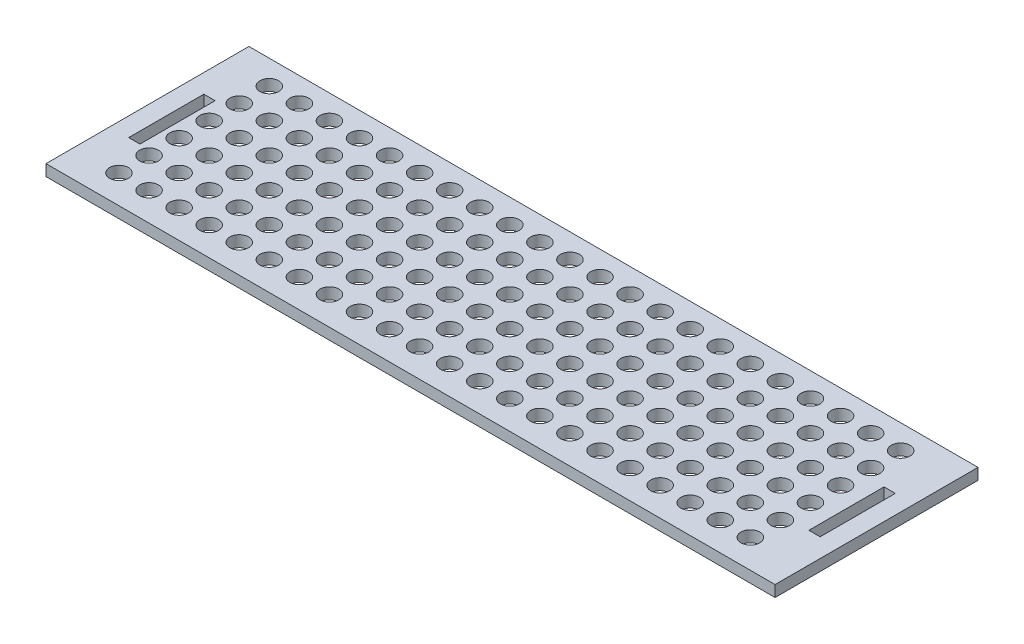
SolidWorks part; units mm, degrees
ref_plane "Front Plane" through (0, 0, 0) normal (0, 0, 1) x (1, 0, 0)
ref_plane "Top Plane" through (0, 0, 0) normal (0, 1, 0) x (1, 0, 0)
ref_plane "Right Plane" through (0, 0, 0) normal (1, 0, 0) x (0, 0, -1)
sketch "Sketch1" plane through (0, 0, 0) normal (0, 1, 0) x (1, 0, 0)
  line L0 (50.8029, -38.0444) -> (50.8029, -58.0444)
  line L1 (-138.1971, -21.0444) -> (55.8029, -21.0444)
  line L2 (-138.1971, -21.0444) -> (-138.1971, -75.0444)
  line L3 (-138.1971, -75.0444) -> (55.8029, -75.0444)
  line L4 (55.8029, -21.0444) -> (55.8029, -75.0444)
  line L6 (47.8029, -38.0444) -> (47.8029, -58.0444)
  line L8 (-130.1971, -38.0444) -> (-130.1971, -58.0444)
  line L9 (-130.1971, -58.0444) -> (-133.1971, -58.0444)
  line L11 (-130.1971, -38.0444) -> (-133.1971, -38.0444)
  line L12 (-133.1971, -38.0444) -> (-133.1971, -58.0444)
  line L14 (47.8029, -58.0444) -> (50.8029, -58.0444)
  line L15 (47.8029, -38.0444) -> (50.8029, -38.0444)
  circle A0 centre (-126.3416, -27.4784) radius 2.5
  circle A1 centre (-118.3416, -27.4784) radius 2.5
  circle A2 centre (-110.3416, -27.4784) radius 2.5
  circle A3 centre (-102.3416, -27.4784) radius 2.5
  circle A4 centre (-94.3416, -27.4784) radius 2.5
  circle A5 centre (-86.3416, -27.4784) radius 2.5
  circle A6 centre (-78.3416, -27.4784) radius 2.5
  circle A7 centre (-70.3416, -27.4784) radius 2.5
  circle A8 centre (-62.3416, -27.4784) radius 2.5
  circle A9 centre (-54.3416, -27.4784) radius 2.5
  circle A10 centre (-46.3416, -27.4784) radius 2.5
  circle A11 centre (-38.3416, -27.4784) radius 2.5
  circle A12 centre (-30.3416, -27.4784) radius 2.5
  circle A13 centre (-22.3416, -27.4784) radius 2.5
  circle A14 centre (-14.3416, -27.4784) radius 2.5
  circle A15 centre (-6.3416, -27.4784) radius 2.5
  circle A16 centre (1.6584, -27.4784) radius 2.5
  circle A17 centre (9.6584, -27.4784) radius 2.5
  circle A18 centre (17.6584, -27.4784) radius 2.5
  circle A19 centre (25.6584, -27.4784) radius 2.5
  circle A20 centre (33.6584, -27.4784) radius 2.5
  circle A21 centre (41.6584, -27.4784) radius 2.5
  circle A22 centre (-126.3416, -35.4784) radius 2.5
  circle A23 centre (-118.3416, -35.4784) radius 2.5
  circle A24 centre (-110.3416, -35.4784) radius 2.5
  circle A25 centre (-102.3416, -35.4784) radius 2.5
  circle A26 centre (-94.3416, -35.4784) radius 2.5
  circle A27 centre (-86.3416, -35.4784) radius 2.5
  circle A28 centre (-78.3416, -35.4784) radius 2.5
  circle A29 centre (-70.3416, -35.4784) radius 2.5
  circle A30 centre (-62.3416, -35.4784) radius 2.5
  circle A31 centre (-54.3416, -35.4784) radius 2.5
  circle A32 centre (-46.3416, -35.4784) radius 2.5
  circle A33 centre (-38.3416, -35.4784) radius 2.5
  circle A34 centre (-30.3416, -35.4784) radius 2.5
  circle A35 centre (-22.3416, -35.4784) radius 2.5
  circle A36 centre (-14.3416, -35.4784) radius 2.5
  circle A37 centre (-6.3416, -35.4784) radius 2.5
  circle A38 centre (1.6584, -35.4784) radius 2.5
  circle A39 centre (9.6584, -35.4784) radius 2.5
  circle A40 centre (17.6584, -35.4784) radius 2.5
  circle A41 centre (25.6584, -35.4784) radius 2.5
  circle A42 centre (33.6584, -35.4784) radius 2.5
  circle A43 centre (41.6584, -35.4784) radius 2.5
  circle A44 centre (-126.3416, -43.4784) radius 2.5
  circle A45 centre (-118.3416, -43.4784) radius 2.5
  circle A46 centre (-110.3416, -43.4784) radius 2.5
  circle A47 centre (-102.3416, -43.4784) radius 2.5
  circle A48 centre (-94.3416, -43.4784) radius 2.5
  circle A49 centre (-86.3416, -43.4784) radius 2.5
  circle A50 centre (-78.3416, -43.4784) radius 2.5
  circle A51 centre (-70.3416, -43.4784) radius 2.5
  circle A52 centre (-62.3416, -43.4784) radius 2.5
  circle A53 centre (-54.3416, -43.4784) radius 2.5
  circle A54 centre (-46.3416, -43.4784) radius 2.5
  circle A55 centre (-38.3416, -43.4784) radius 2.5
  circle A56 centre (-30.3416, -43.4784) radius 2.5
  circle A57 centre (-22.3416, -43.4784) radius 2.5
  circle A58 centre (-14.3416, -43.4784) radius 2.5
  circle A59 centre (-6.3416, -43.4784) radius 2.5
  circle A60 centre (1.6584, -43.4784) radius 2.5
  circle A61 centre (9.6584, -43.4784) radius 2.5
  circle A62 centre (17.6584, -43.4784) radius 2.5
  circle A63 centre (25.6584, -43.4784) radius 2.5
  circle A64 centre (33.6584, -43.4784) radius 2.5
  circle A65 centre (41.6584, -43.4784) radius 2.5
  circle A66 centre (-126.3416, -51.4784) radius 2.5
  circle A67 centre (-118.3416, -51.4784) radius 2.5
  circle A68 centre (-110.3416, -51.4784) radius 2.5
  circle A69 centre (-102.3416, -51.4784) radius 2.5
  circle A70 centre (-94.3416, -51.4784) radius 2.5
  circle A71 centre (-86.3416, -51.4784) radius 2.5
  circle A72 centre (-78.3416, -51.4784) radius 2.5
  circle A73 centre (-70.3416, -51.4784) radius 2.5
  circle A74 centre (-62.3416, -51.4784) radius 2.5
  circle A75 centre (-54.3416, -51.4784) radius 2.5
  circle A76 centre (-46.3416, -51.4784) radius 2.5
  circle A77 centre (-38.3416, -51.4784) radius 2.5
  circle A78 centre (-30.3416, -51.4784) radius 2.5
  circle A79 centre (-22.3416, -51.4784) radius 2.5
  circle A80 centre (-14.3416, -51.4784) radius 2.5
  circle A81 centre (-6.3416, -51.4784) radius 2.5
  circle A82 centre (1.6584, -51.4784) radius 2.5
  circle A83 centre (9.6584, -51.4784) radius 2.5
  circle A84 centre (17.6584, -51.4784) radius 2.5
  circle A85 centre (25.6584, -51.4784) radius 2.5
  circle A86 centre (33.6584, -51.4784) radius 2.5
  circle A87 centre (41.6584, -51.4784) radius 2.5
  circle A88 centre (-126.3416, -59.4784) radius 2.5
  circle A89 centre (-118.3416, -59.4784) radius 2.5
  circle A90 centre (-110.3416, -59.4784) radius 2.5
  circle A91 centre (-102.3416, -59.4784) radius 2.5
  circle A92 centre (-94.3416, -59.4784) radius 2.5
  circle A93 centre (-86.3416, -59.4784) radius 2.5
  circle A94 centre (-78.3416, -59.4784) radius 2.5
  circle A95 centre (-70.3416, -59.4784) radius 2.5
  circle A96 centre (-62.3416, -59.4784) radius 2.5
  circle A97 centre (-54.3416, -59.4784) radius 2.5
  circle A98 centre (-46.3416, -59.4784) radius 2.5
  circle A99 centre (-38.3416, -59.4784) radius 2.5
  circle A100 centre (-30.3416, -59.4784) radius 2.5
  circle A101 centre (-22.3416, -59.4784) radius 2.5
  circle A102 centre (-14.3416, -59.4784) radius 2.5
  circle A103 centre (-6.3416, -59.4784) radius 2.5
  circle A104 centre (1.6584, -59.4784) radius 2.5
  circle A105 centre (9.6584, -59.4784) radius 2.5
  circle A106 centre (17.6584, -59.4784) radius 2.5
  circle A107 centre (25.6584, -59.4784) radius 2.5
  circle A108 centre (33.6584, -59.4784) radius 2.5
  circle A109 centre (41.6584, -59.4784) radius 2.5
  circle A110 centre (-126.3416, -67.4784) radius 2.5
  circle A111 centre (-118.3416, -67.4784) radius 2.5
  circle A112 centre (-110.3416, -67.4784) radius 2.5
  circle A113 centre (-102.3416, -67.4784) radius 2.5
  circle A114 centre (-94.3416, -67.4784) radius 2.5
  circle A115 centre (-86.3416, -67.4784) radius 2.5
  circle A116 centre (-78.3416, -67.4784) radius 2.5
  circle A117 centre (-70.3416, -67.4784) radius 2.5
  circle A118 centre (-62.3416, -67.4784) radius 2.5
  circle A119 centre (-54.3416, -67.4784) radius 2.5
  circle A120 centre (-46.3416, -67.4784) radius 2.5
  circle A121 centre (-38.3416, -67.4784) radius 2.5
  circle A122 centre (-30.3416, -67.4784) radius 2.5
  circle A123 centre (-22.3416, -67.4784) radius 2.5
  circle A124 centre (-14.3416, -67.4784) radius 2.5
  circle A125 centre (-6.3416, -67.4784) radius 2.5
  circle A126 centre (1.6584, -67.4784) radius 2.5
  circle A127 centre (9.6584, -67.4784) radius 2.5
  circle A128 centre (17.6584, -67.4784) radius 2.5
  circle A129 centre (25.6584, -67.4784) radius 2.5
  circle A130 centre (33.6584, -67.4784) radius 2.5
  circle A131 centre (41.6584, -67.4784) radius 2.5
  dimension "D1" = 6
  dimension "D2" = 22
extrude "Boss-Extrude1" add sketch "Sketch1" along normal blind 3
